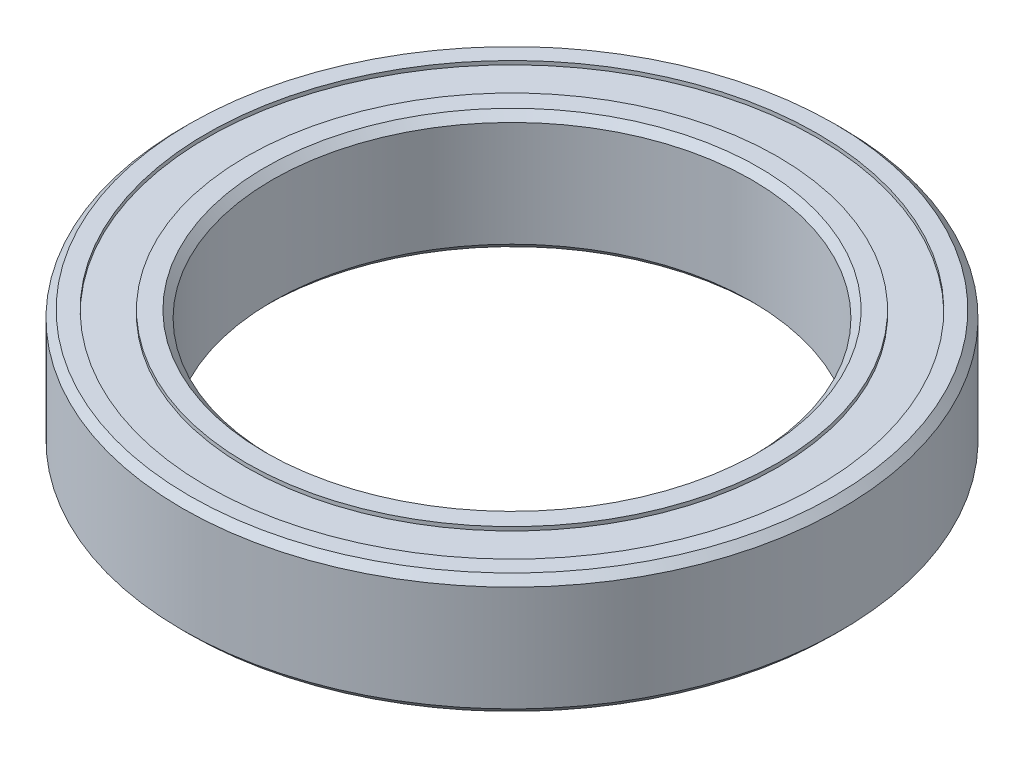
SolidWorks part; units mm, degrees
ref_plane "Front" through (0, 0, 0) normal (0, 0, 1) x (1, 0, 0)
ref_plane "Top" through (0, 0, 0) normal (0, 1, 0) x (1, 0, 0)
ref_plane "Right" through (0, 0, 0) normal (1, 0, 0) x (0, 0, -1)
sketch "Sketch1" plane through (0, 0, 0) normal (0, 1, 0) x (1, 0, 0)
  circle A0 centre (0, 0) radius 12.7
  circle A1 centre (0, 0) radius 17.4625
  dimension "D1" = 34.925
  dimension "D2" = 25.4
extrude "Extrude1" add sketch "Sketch1" along normal mid plane 6.35
sketch "Sketch2" plane through (0, 3.175, 0) normal (0, 1, 0) x (-1, 0, 0)
  circle A0 centre (0, 0) radius 14.0716
  circle A1 centre (0, 0) radius 16.1798
  dimension "D1" = 28.1432
  dimension "D2" = 32.3596
extrude "Seal" cut sketch "Sketch2" against normal blind 0.2
mirror "Mirror1" about plane through (0, 0, 0) normal (0, 1, 0) of "Seal"
chamfer "Chamfer1" distance 0.381 angle 45 4 edges at (0, -3.175, 17.4625) (0, -3.175, 12.7) (0, 3.175, 12.7) (0, 3.175, 17.4625)
